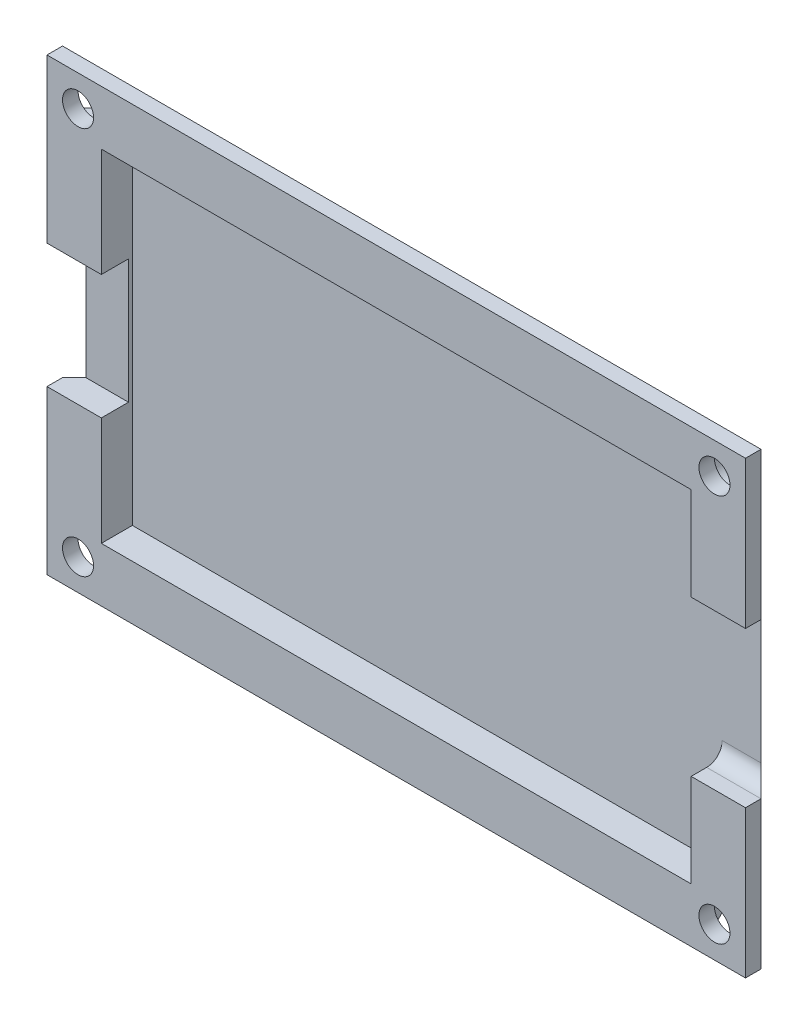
SolidWorks part; units mm, degrees
ref_plane "Alzado" through (0, 0, 0) normal (0, 0, 1) x (1, 0, 0)
ref_plane "Planta" through (0, 0, 0) normal (0, 1, 0) x (1, 0, 0)
ref_plane "Vista lateral" through (0, 0, 0) normal (1, 0, 0) x (0, 0, -1)
sketch "Sketch1" plane through (0, 0, 0) normal (0, 0, 1) x (1, 0, 0)
  line L1 (-22.5, -14.5) -> (22.5, -14.5)
  line L2 (-22.5, -14.5) -> (-22.5, 14.5)
  line L3 (-22.5, 14.5) -> (22.5, 14.5)
  line L4 (22.5, -14.5) -> (22.5, 14.5)
  line L5 (-22.5, -14.5) -> (22.5, 14.5) construction
  line L6 (-22.5, 14.5) -> (22.5, -14.5) construction
  point P0 (0, 0)
  dimension "D1" = 45
  dimension "D2" = 29
extrude "Boss-Extrude1" add sketch "Sketch1" along normal blind 3
sketch "Sketch2" plane through (0, 0, 3) normal (0, 0, 1) x (1, 0, 0)
  line L0 (22.5, 14.5) -> (-22.5, 14.5) construction
  line L1 (-19, -11) -> (19, -11)
  line L2 (-19, -11) -> (-19, 11)
  line L3 (-19, 11) -> (19, 11)
  line L4 (19, -11) -> (19, 11)
  line L5 (-19, -11) -> (19, 11) construction
  line L6 (-19, 11) -> (19, -11) construction
  line L7 (22.5, -14.5) -> (22.5, 14.5) construction
  point P0 (0, 0)
  dimension "D1" = 3.5
  dimension "D2" = 3.5
extrude "Cut-Extrude1" cut sketch "Sketch2" against normal blind 2
sketch "Sketch3" plane through (22.5, 0, 0) normal (1, 0, 0) x (0, 0, -1)
  line L0 (-3, -14.5) -> (-3, 14.5) construction
  line L1 (-4, 5) -> (-2, 5)
  line L2 (-5, 4) -> (-5, -4)
  line L3 (-4, -5) -> (-2, -5)
  line L4 (-1, 4) -> (-1, -4)
  line L5 (-5, 5) -> (-1, -5) construction
  line L6 (-5, -5) -> (-1, 5) construction
  arc A0 (-5, -4) -> (-4, -5) centre (-4, -4) ccw
  arc A1 (-2, -5) -> (-1, -4) centre (-2, -4) ccw
  arc A2 (-2, 5) -> (-1, 4) centre (-2, 4) cw
  arc A3 (-4, 5) -> (-5, 4) centre (-4, 4) ccw
  point P0 (-3, 0)
  dimension "D3" = 1
  dimension "D1" = 4
  dimension "D2" = 10
extrude "Cut-Extrude2" cut sketch "Sketch3" against normal blind 9
sketch "Sketch4" plane through (-22.5, 0, 0) normal (-1, 0, 0) x (0, 0, 1)
  line L0 (3, 14.5) -> (3, -14.5) construction
  line L1 (1.25, 4) -> (4.75, 4)
  line L2 (1.25, 4) -> (1.25, -4)
  line L3 (1.25, -4) -> (4.75, -4)
  line L4 (4.75, 4) -> (4.75, -4)
  line L5 (1.25, 4) -> (4.75, -4) construction
  line L6 (1.25, -4) -> (4.75, 4) construction
  point P0 (3, 0)
  dimension "D1" = 3.5
  dimension "D2" = 8
extrude "Cut-Extrude3" cut sketch "Sketch4" against normal blind 9
sketch "Sketch5" plane through (0, 0, 3) normal (0, 0, 1) x (1, 0, 0)
  line L0 (0, 5.611) -> (0, -4.8321) construction
  line L1 (-4.8176, 0) -> (7.0967, 0) construction
  line L2 (-22.5, 14.5) -> (-22.5, 4) construction
  line L3 (22.5, 14.5) -> (-22.5, 14.5) construction
  circle A0 centre (-20.5, 12.5) radius 1
  circle A1 centre (20.5, 12.5) radius 1
  circle A2 centre (20.5, -12.5) radius 1
  circle A3 centre (-20.5, -12.5) radius 1
  dimension "D1" = 2
  dimension "D2" = 2
  dimension "D3" = 2
extrude "Cut-Extrude4" cut sketch "Sketch5" against normal blind 9
sketch "Sketch6" plane through (0, 0, 0) normal (0, 0, -1) x (-1, 0, 0)
  line L0 (-4.3116, 0) -> (6.8298, 0) construction
  line L5 (-22.5, 14.5) -> (-19.05, 14.5)
  line L6 (-22.5, 14.5) -> (-22.5, 11.05)
  line L7 (-22.5, 11.05) -> (-19.05, 11.05)
  line L8 (-19.05, 14.5) -> (-19.05, 11.05)
  line L9 (0, 6.9121) -> (0, -4.7281) construction
  line L10 (19.05, 14.5) -> (19.05, 11.05)
  line L11 (22.5, 11.05) -> (19.05, 11.05)
  line L12 (22.5, 14.5) -> (22.5, 11.05)
  line L13 (22.5, 14.5) -> (19.05, 14.5)
  line L14 (22.5, -14.5) -> (19.05, -14.5)
  line L15 (22.5, -14.5) -> (22.5, -11.05)
  line L16 (22.5, -11.05) -> (19.05, -11.05)
  line L17 (19.05, -14.5) -> (19.05, -11.05)
  line L18 (-19.05, -14.5) -> (-19.05, -11.05)
  line L19 (-22.5, -11.05) -> (-19.05, -11.05)
  line L20 (-22.5, -14.5) -> (-22.5, -11.05)
  line L21 (-22.5, -14.5) -> (-19.05, -14.5)
  dimension "D1" = 3.45
  dimension "D2" = 3.45
extrude "Cut-Extrude5" cut sketch "Sketch6" against normal blind 2
chamfer "Chamfer1" distance 2 angle 45 4 edges at (22.5, 0, 0) (0, -14.5, 0) (-22.5, 0, 0) (0, 14.5, 0)
fillet "Fillet1" radius 1 4 edges at (19.05, 11.05, 1) (19.05, -11.05, 1) (-19.05, -11.05, 1) (-19.05, 11.05, 1)
